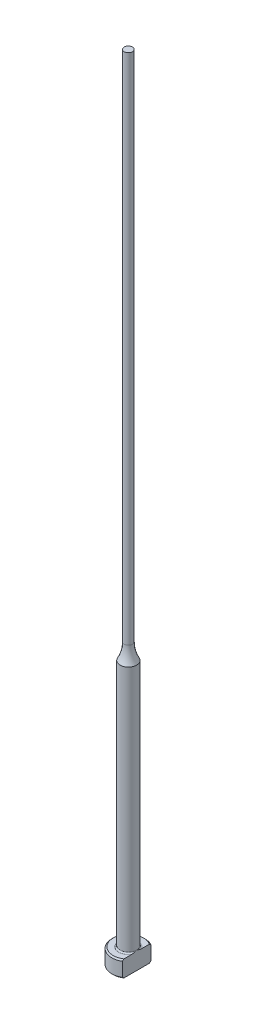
SolidWorks part; units mm, degrees
ref_plane "Front Plane" through (0, 0, 0) normal (0, 0, 1) x (1, 0, 0)
ref_plane "Top Plane" through (0, 0, 0) normal (0, 1, 0) x (1, 0, 0)
ref_plane "Right Plane" through (0, 0, 0) normal (1, 0, 0) x (0, 0, -1)
sketch "Sketch1" plane through (0, 0, 0) normal (0, 0, 1) x (1, 0, 0)
  line L0 (0, 259.9588) -> (0, -15.1925) construction
  line L1 (0, 0) -> (-3.175, 0)
  line L2 (-3.175, 0) -> (-3.175, 3.175)
  line L3 (-3.175, 3.175) -> (-1.5875, 3.175)
  line L4 (-0.7937, 53.8742) -> (-0.7937, 152.4)
  line L5 (-0.7937, 152.4) -> (0, 152.4)
  line L6 (0, 152.4) -> (0, 0)
  line L7 (-1.5875, 3.175) -> (-1.5875, 50.8)
  arc A0 (-1.5875, 50.8) -> (-0.7937, 53.8742) centre (-7.1437, 53.8742) ccw
  point P13 (-1.5875, 0)
  dimension "D1" = 6.35
  dimension "L" = 152.4
  dimension "D2" = 3.175
  dimension "H" = 6.35
  dimension "T" = 3.175
  dimension "D" = 1.5875
  dimension "S" = 50.8
revolve "Revolve1" add sketch "Sketch1" angle 360 about L0
chamfer "Chamfer1" distance 0.254 angle 45 2 edges at (0, 3.175, 3.175) (0, 0, 3.175)
fillet "Fillet1" radius 0.254 1 edges at (0, 3.175, 1.5875)
sketch "Sketch2" plane through (0, 0, 0) normal (0, 1, 0) x (1, 0, 0)
  line L0 (1.5875, -2.7496) -> (1.5875, 2.7496)
  circle A0 centre (0, 0) radius 3.175 construction
  arc A2 (1.5875, -2.7496) -> (1.5875, 2.7496) centre (0, 0) ccw
  circle A3 centre (0, 0) radius 3.175 construction
  circle A4 centre (0, 0) radius 1.5875 construction
extrude "Key Head" cut sketch "Sketch2" along normal up to next
